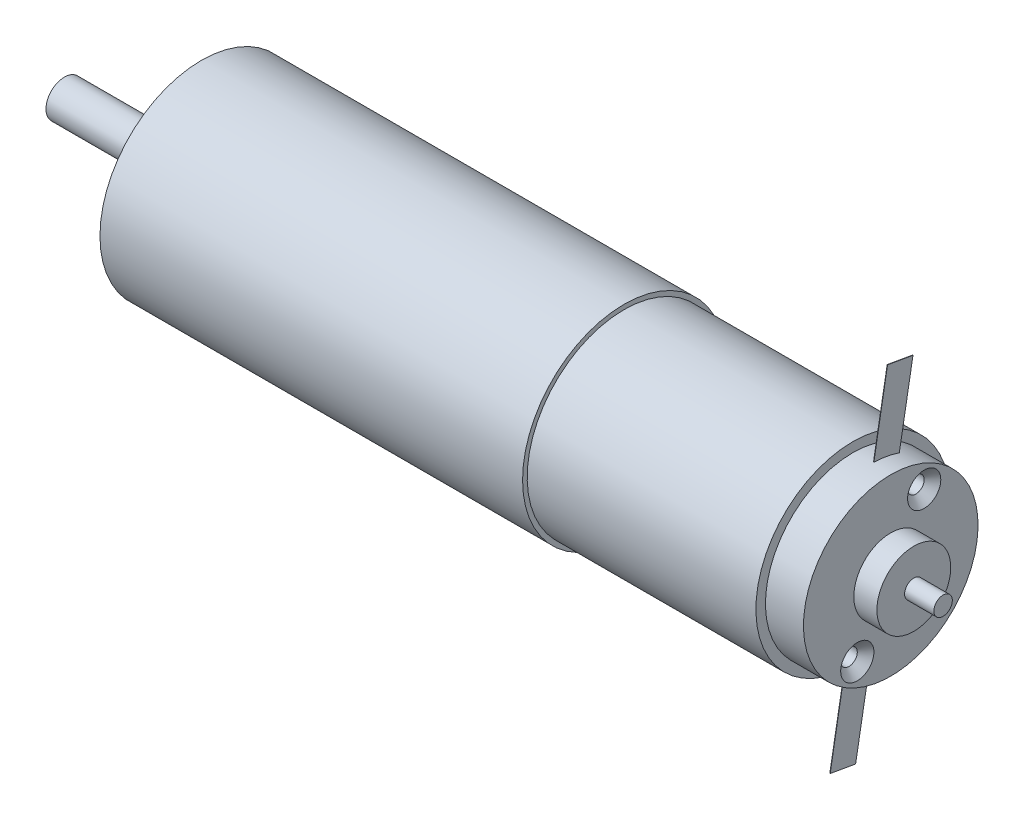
SolidWorks part; units mm, degrees
ref_plane "Front Plane" through (0, 0, 0) normal (0, 0, 1) x (1, 0, 0)
ref_plane "Top Plane" through (0, 0, 0) normal (0, 1, 0) x (1, 0, 0)
ref_plane "Right Plane" through (0, 0, 0) normal (1, 0, 0) x (0, 0, -1)
sketch "Sketch1" plane through (0, 0, 0) normal (0, 0, 1) x (1, 0, 0)
  line L0 (44.9, 0) -> (-60.65, 0) construction
  line L1 (0, -10.5) -> (24.7852, -10.5)
  line L2 (0, -10.5) -> (0, -11)
  line L3 (0, -11) -> (-45.8, -11)
  line L4 (24.7852, -10.5) -> (24.7852, -9.4615)
  line L5 (-45.8, -11) -> (-45.8, -5)
  line L6 (-45.8, -5) -> (-47.15, -5)
  line L7 (-47.15, -5) -> (-47.15, -3.4925)
  line L8 (-47.15, -3.4925) -> (-48.95, -3.4925)
  line L9 (-48.95, -3.4925) -> (-48.95, -2)
  line L10 (-48.95, -2) -> (-60.65, -2)
  line L11 (-60.65, -2) -> (-60.65, 0)
  line L12 (28.9, -4) -> (31.4, -4)
  line L13 (24.7852, -9.4615) -> (28.9, -9.4615)
  line L14 (28.9, -9.4615) -> (28.9, -4)
  line L15 (31.4, -4) -> (31.4, -1)
  line L16 (31.4, -1) -> (44.9, -1)
  line L17 (44.9, -1) -> (44.9, 0)
  line L18 (-60.65, 0) -> (44.9, 0)
  dimension "D1" = 22
  dimension "D2" = 28.9
  dimension "D3" = 21
  dimension "D4" = 45.8
  dimension "D5" = 10
  dimension "D6" = 1.35
  dimension "D7" = 6.985
  dimension "D8" = 3.15
  dimension "D9" = 4
  dimension "D10" = 14.85
  dimension "D11" = 18.923
  dimension "D12" = 4.1148
  dimension "D13" = 8
  dimension "D14" = 2.5
  dimension "D15" = 2
  dimension "D16" = 16
revolve "Revolve1" add sketch "Sketch1" angle 360 about L0
sketch "Sketch6" plane through (0, 0, 0) normal (0, 1, 0) x (1, 0, 0)
  line L0 (-60.65, 2) -> (-60.65, -2) construction
  line L1 (-63.9871, 5.1812) -> (-51.35, 5.1812)
  line L2 (-63.9871, 5.1812) -> (-63.9871, 1.5)
  line L3 (-63.9871, 1.5) -> (-51.35, 1.5)
  line L4 (-51.35, 5.1812) -> (-51.35, 1.5)
  line L5 (-60.65, -2) -> (-48.95, -2) construction
  dimension "D1" = 9.3
  dimension "D2" = 3.5
extrude "Cut-Extrude2" cut sketch "Sketch6" against normal through all and the other way through all
sketch "Sketch2" plane through (24.7852, 0, 0) normal (1, 0, 0) x (0, 0, -1)
  line L0 (0.9263, 5.2534) -> (0, 0) construction
  line L1 (1.7296, 17.8712) -> (-0.4524, 5.4965)
  line L2 (1.7296, 17.8712) -> (4.487, 17.385)
  line L3 (4.487, 17.385) -> (2.305, 5.0103)
  line L4 (-0.4524, 5.4965) -> (2.305, 5.0103)
  line L5 (0.9263, 5.2534) -> (3.1083, 17.6281) construction
  line L6 (0, 0) -> (0, 15.5687) construction
  line L7 (0, 0) -> (-7.582, 1.3369) construction
  line L8 (-4.487, -17.385) -> (-1.7296, -17.8712)
  line L9 (-4.487, -17.385) -> (-2.305, -5.0103)
  line L10 (-1.7296, -17.8712) -> (0.4524, -5.4965)
  line L11 (-2.305, -5.0103) -> (0.4524, -5.4965)
  dimension "D1" = 2.8
  dimension "D2" = 17.9
  dimension "D3" = 10
extrude "Extrude1" add sketch "Sketch2" along normal blind 0.04 from offset 2
hole_wizard "M2.5x0.45 Tapped Hole1" positions "Sketch5" profile "Sketch4" tap size "M2.5x0.45" standard "Ansi Metric"
sketch "Sketch5" plane through (-45.8, 0, 0) normal (-1, 0, 0) x (0, 0, 1)
  line L0 (0, 0) -> (0, 7) construction
  line L1 (0, 0) -> (6.0622, -3.5) construction
  line L2 (0, 0) -> (-6.0622, -3.5) construction
  circle A0 centre (0, 0) radius 7 construction
  point P0 (0, 7)
  point P1 (6.0622, -3.5)
  point P3 (-6.0622, -3.5)
  dimension "D3" = 14
  dimension "D1" = 120
  dimension "D2" = 120
sketch "Sketch4" plane through (-45.8, 7, 0) normal (0, 1, 0) x (0, 0, 1)
  line L0 (0, 0) -> (0, 5.9659)
  line L1 (0, 5.9659) -> (1.025, 5.35)
  line L2 (1.025, 5.35) -> (1.025, 0)
  line L5 (1.025, 0) -> (0, 0)
  line L10 (0, 5.9659) -> (-1.025, 5.35) construction
  line L11 (0, -6.35) -> (0, 107.95) construction
  dimension "Tap Drill Dia." = 2.05
  dimension "Tap Drill Depth" = 5.35
  dimension "Drill Angle" = 118
hole_wizard "CSK for M1.6 Countersunk Flat Head1" positions "Sketch8" profile "Sketch7" countersink size "M1.6" standard "BSI"
sketch "Sketch8" plane through (28.9, 0, 0) normal (1, 0, 0) x (0, 0, -1)
  line L0 (0, 0) -> (0, 12.9146) construction
  line L1 (0, 0) -> (3.625, 6.2787) construction
  line L2 (0, 0) -> (-3.625, -6.2787) construction
  circle A0 centre (0, 0) radius 7.25 construction
  point P0 (3.625, 6.2787)
  point P11 (-3.625, -6.2787)
  dimension "D1" = 30
  dimension "D2" = 14.5
sketch "Sketch7" plane through (28.9, 6.2787, -3.625) normal (0, 1, 0) x (0, 0, -1)
  line L0 (0, 0) -> (0, 4.8908)
  line L1 (0, 4.8908) -> (0.9, 4.35)
  line L2 (0.9, 4.35) -> (0.9, 0.9)
  line L3 (0.9, 0.9) -> (1.8, 0)
  line L5 (1.8, 0) -> (0, 0)
  line L6 (-0.9, 0.9) -> (-1.8, 0) construction
  line L10 (0, 4.8908) -> (-0.9, 4.35) construction
  line L11 (0, -6.35) -> (0, 107.95) construction
  dimension "Hole Dia." = 1.8
  dimension "Hole Depth" = 4.35
  dimension "Near C'Sink Dia." = 3.6
  dimension "Near C'Sink Angle" = 90
  dimension "Drill Angle" = 118
ref_plane "Plane1" through (0, 0, 0) normal (0, 0, 1) x (1, 0, 0)
sketch "Sketch9" plane through (0, 0, 0) normal (0, 0, 1) x (1, 0, 0)
  line L0 (31.4, -1) -> (44.9, -1) construction
  line L1 (44.9, 1) -> (34.575, 1)
  line L2 (44.9, 1) -> (44.9, -1)
  line L3 (44.9, -1) -> (34.575, -1)
  line L4 (34.575, 1) -> (34.575, -1)
  line L5 (31.4, -4) -> (31.4, 4) construction
  dimension "D1" = 3.175
extrude "Cut-Extrude3" cut sketch "Sketch9" against normal through all both and the other way through all
